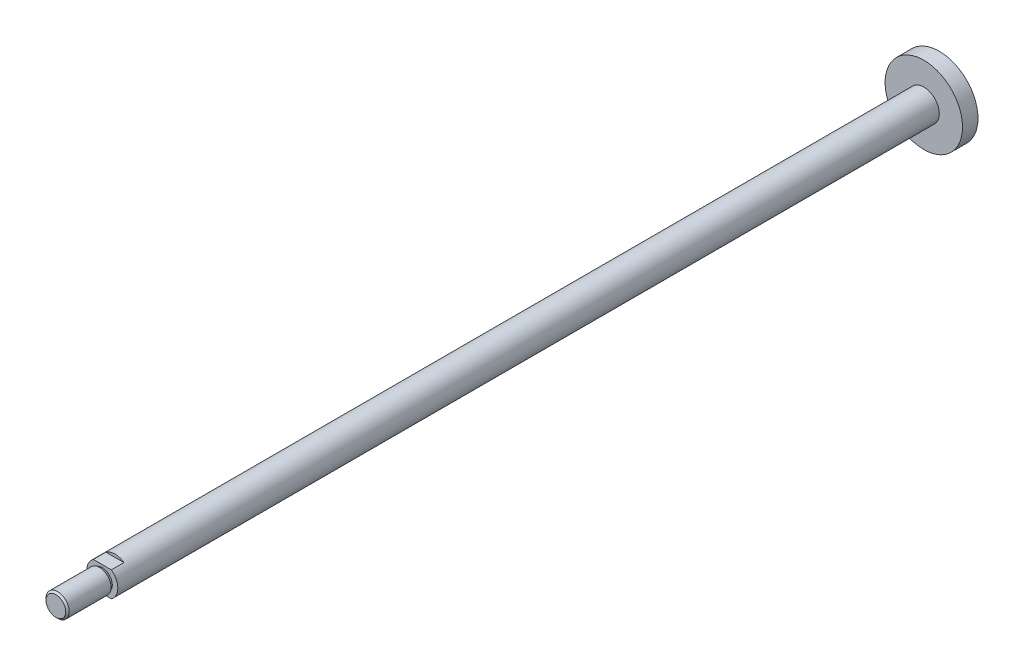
SolidWorks part; units mm, degrees
ref_plane "Plan de face" through (0, 0, 0) normal (0, 0, 1) x (1, 0, 0)
ref_plane "Plan de dessus" through (0, 0, 0) normal (0, 1, 0) x (1, 0, 0)
ref_plane "Plan de droite" through (0, 0, 0) normal (1, 0, 0) x (0, 0, -1)
imported_body "Importée1"
sketch "Esquisse1" plane through (0, 0, 0) normal (0, 1, 0) x (1, 0, 0)
  line L1 (-20, 544.5) -> (20, 544.5)
  line L2 (-20, 544.5) -> (-20, 394.5)
  line L3 (-20, 394.5) -> (20, 394.5)
  line L4 (20, 544.5) -> (20, 394.5)
  dimension "D1" = 150
extrude "Enlèv. mat.-Extru.1" cut sketch "Esquisse1" against normal mid plane 20
move or copy body "Corps-Déplacer/Copier1" bodies to move or copy 102 copy no translate (0, 0, -150)
